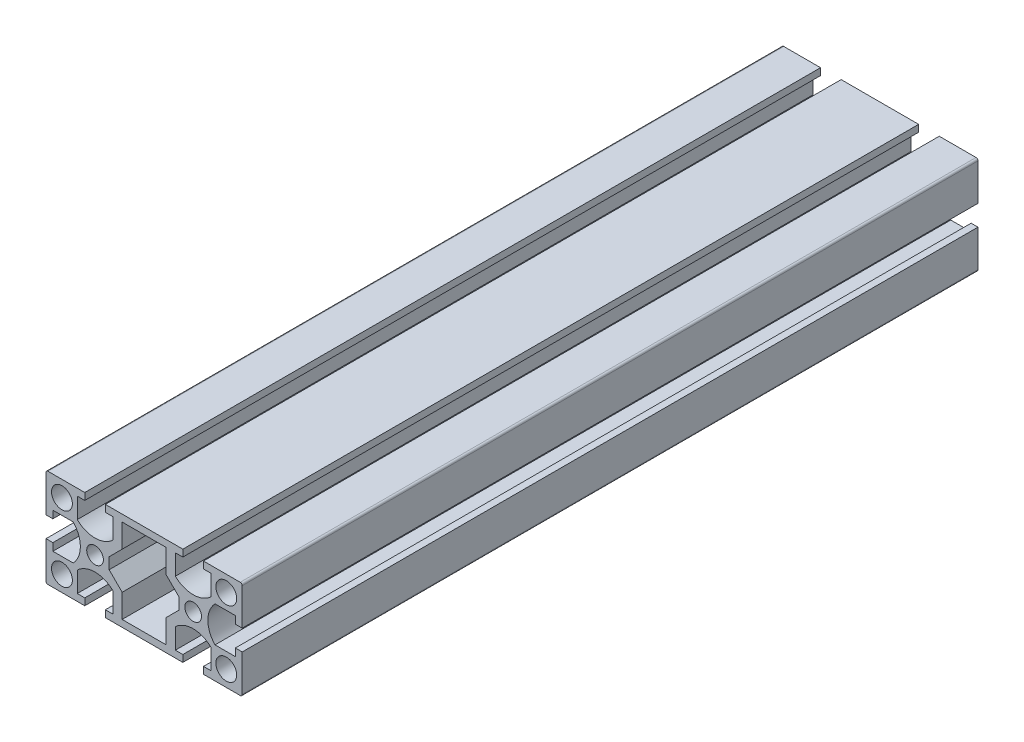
SolidWorks part; units mm, degrees
ref_plane "前视基准面" through (0, 0, 0) normal (0, 0, 1) x (1, 0, 0)
ref_plane "上视基准面" through (0, 0, 0) normal (0, 1, 0) x (1, 0, 0)
ref_plane "右视基准面" through (0, 0, 0) normal (1, 0, 0) x (0, 0, -1)
sketch "草图1"
sketch_block_instance "A$C601040DC-1"
sketch_block "A$C601040DC"
extrude "凸台-拉伸1" add sketch "草图1" along normal mid plane 300
